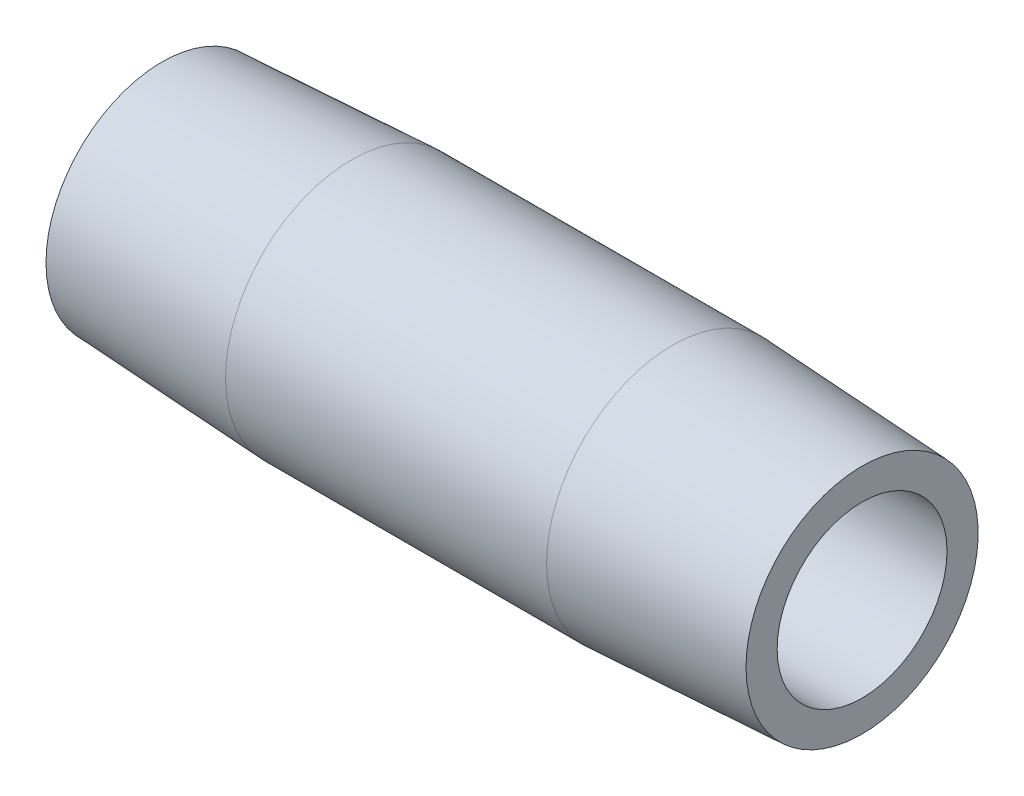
SolidWorks part; units mm, degrees
ref_plane "Front Plane" through (0, 0, 0) normal (0, 0, 1) x (1, 0, 0)
ref_plane "Top Plane" through (0, 0, 0) normal (0, 1, 0) x (1, 0, 0)
ref_plane "Right Plane" through (0, 0, 0) normal (1, 0, 0) x (0, 0, -1)
sketch "Sketch1" plane through (0, 0, 0) normal (0, 1, 0) x (1, 0, 0)
  line L6 (38.1, 4.6228) -> (0, 4.6228)
  line L7 (10.3124, 6.858) -> (0, 6.3175)
  line L8 (0, 6.3175) -> (0, 4.6228)
  line L9 (27.7876, 6.858) -> (10.3124, 6.858)
  line L10 (38.1, 6.3175) -> (27.7876, 6.858)
  line L11 (38.1, 4.6228) -> (38.1, 6.3175)
  line L12 (-6.376, 0) -> (49993.624, 0) construction
  dimension "D1" = 9.2456
  dimension "D2" = 13.716
  dimension "D3" = 3
  dimension "D4" = 3
  dimension "D5" = 38.1
  dimension "D6" = 10.3124
  dimension "D7" = 10.3124
revolve "Revolve1" add sketch "Sketch1" angle 360 about L12
